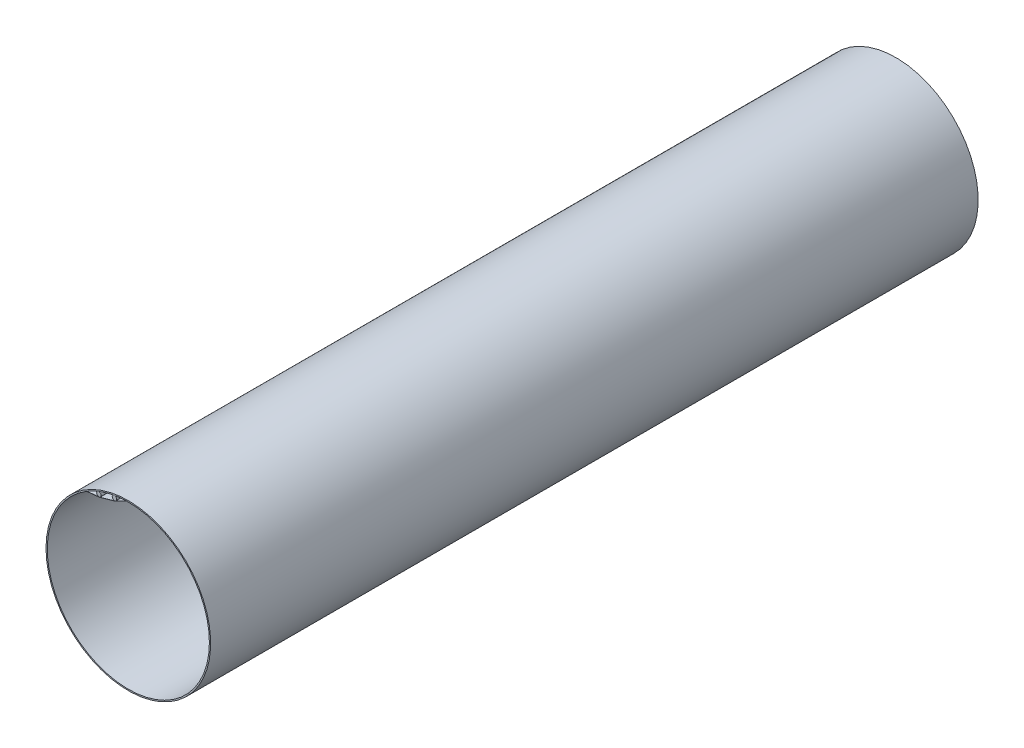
SolidWorks part; units mm, degrees
ref_plane "Front Plane" through (0, 0, 0) normal (0, 0, 1) x (1, 0, 0)
ref_plane "Top Plane" through (0, 0, 0) normal (0, 1, 0) x (1, 0, 0)
ref_plane "Right Plane" through (0, 0, 0) normal (1, 0, 0) x (0, 0, -1)
ref_plane "Plane2" through (0, 0, -4365.0916) normal (0, 0, -1) x (-1, 0, 0)
sketch "Sketch3" plane through (0, 0, -4365.0916) normal (0, 0, -1) x (-1, 0, 0)
  circle A0 centre (0, 0) radius 461.01
  circle A1 centre (0, 0) radius 468.1982
  dimension "D1" = 922.02
  dimension "D2" = 936.3964
extrude "Extrude3" add sketch "Sketch3" against normal blind 4365.1018 separate body
sketch "Sketch2" plane through (0, 0, -4365.0916) normal (0, 0, -1) x (-1, 0, 0)
  line L0 (78.8144, 441.3277) -> (167.0296, 416.0324) construction
  line L2 (122.922, 428.6801) -> (0, 0) construction
  line L3 (0, 0) -> (0, 461.01) construction
  circle A0 centre (78.8144, 441.3277) radius 12.7
  circle A1 centre (167.0296, 416.0324) radius 12.7
  circle A2 centre (0, 0) radius 461.01 construction
  dimension "D2" = 25.4
  dimension "D1" = 25.4
  dimension "D4" = 91.7702
  dimension "D6" = 16
extrude "Extrude2" add sketch "Sketch2" against normal blind 4365.0916 separate body
sketch "Sketch4" plane through (0, 0, -4365.0916) normal (0, 0, -1) x (-1, 0, 0)
  line L0 (10.591, 460.8883) -> (75.1787, 428.6483)
  line L1 (75.1787, 428.6483) -> (163.3938, 403.353)
  line L2 (163.3938, 403.353) -> (235.2519, 396.4678)
  line L3 (8.8097, 460.9258) -> (74.9012, 427.9351)
  line L4 (74.9012, 427.9351) -> (163.2513, 402.6011)
  line L5 (163.2513, 402.6011) -> (236.7824, 395.5557)
  line L8 (119.0762, 415.2681) -> (0, 0) construction
  line L9 (0, 461.01) -> (0, 0) construction
  circle A0 centre (0, 0) radius 461.01 construction
  arc A3 (236.7824, 395.5557) -> (235.2519, 396.4678) centre (0, 0) ccw
  arc A4 (10.591, 460.8883) -> (8.8097, 460.9258) centre (0, 0) ccw
  dimension "D1" = 237.1598
  dimension "D3" = 432.0032
  dimension "D4" = 16
  dimension "D2" = 0.762
  dimension "D5" = 0.762
  dimension "D6" = 0.762
  dimension "D7" = 91.7702
extrude "Extrude4" add sketch "Sketch4" against normal up to surface (4365.1018 mm away)
ref_plane "Plane3" through (0, 0, -2182.5407) normal (0, 0, 1) x (1, 0, 0)
